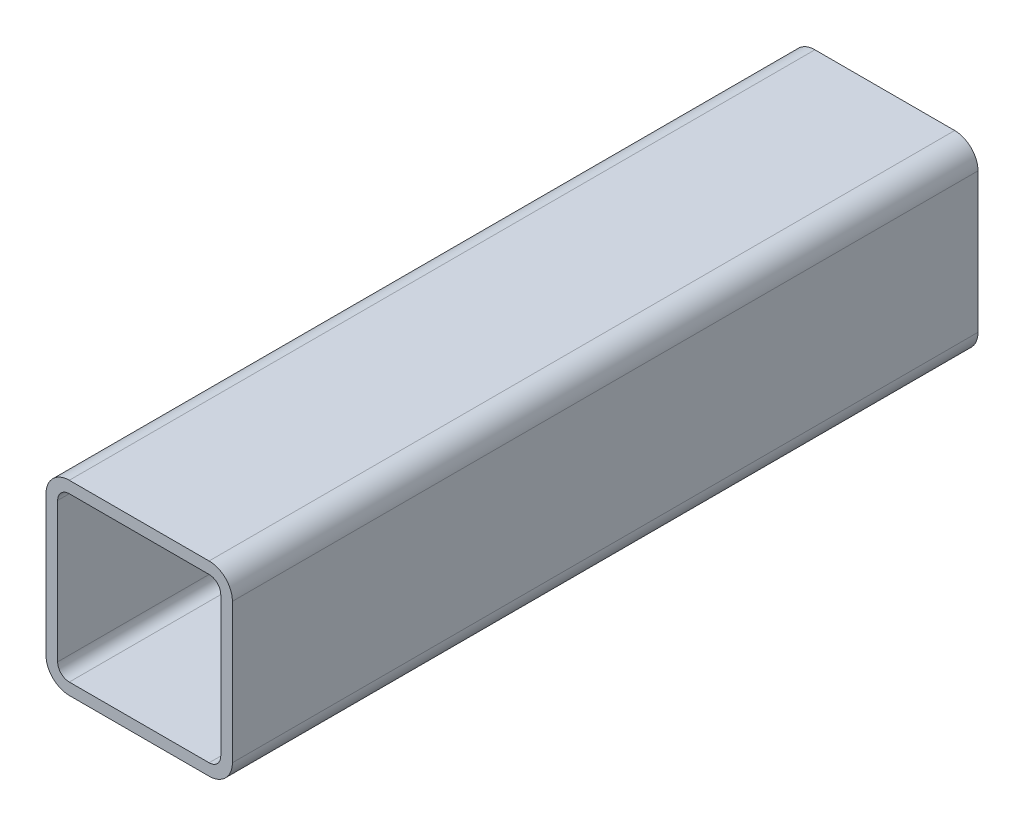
SolidWorks part; units mm, degrees
ref_plane "Front Plane" through (0, 0, 0) normal (0, 0, 1) x (1, 0, 0)
ref_plane "Top Plane" through (0, 0, 0) normal (0, 1, 0) x (1, 0, 0)
ref_plane "Right Plane" through (0, 0, 0) normal (1, 0, 0) x (0, 0, -1)
sketch "Sketch1" plane through (0, 0, 0) normal (0, 0, 1) x (1, 0, 0)
sketch_block_instance "HSS3x3x0.1875-1"
sketch_block "HSS3x3x0.1875"
extrude "Boss-Extrude1" add sketch "Sketch1" along normal blind 304.8
